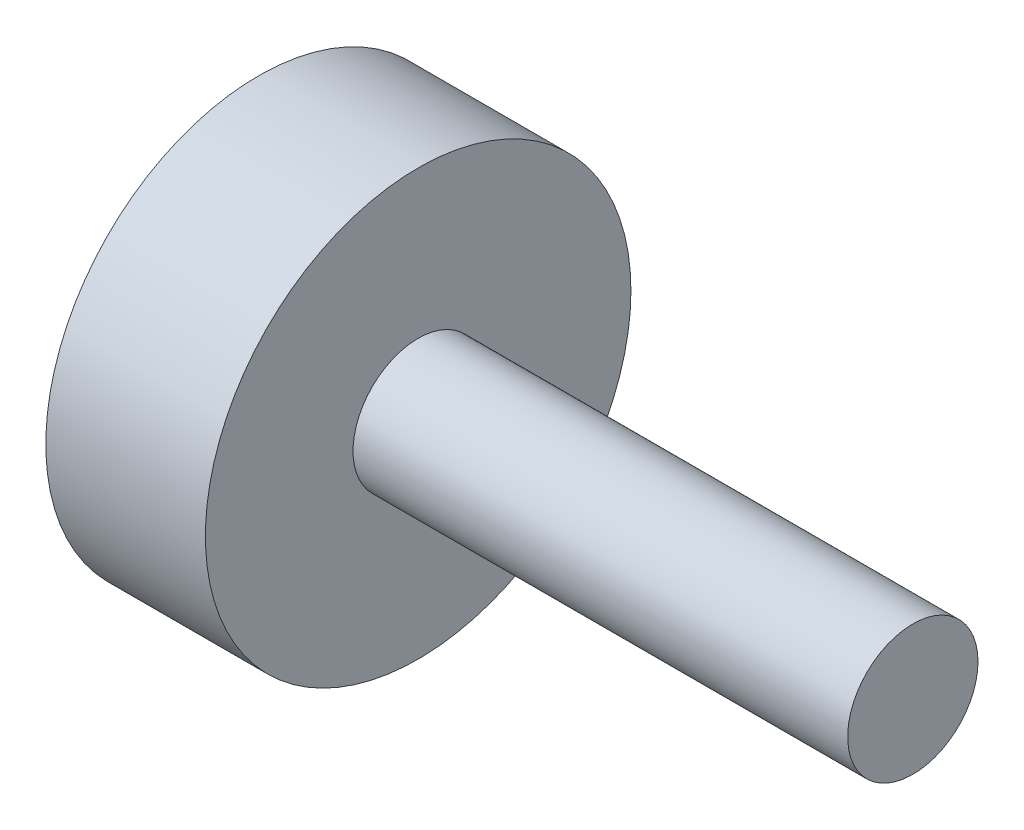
SolidWorks part; units mm, degrees
ref_plane "Front" through (0, 0, 0) normal (0, 0, 1) x (1, 0, 0)
ref_plane "Top" through (0, 0, 0) normal (0, 1, 0) x (1, 0, 0)
ref_plane "Right" through (0, 0, 0) normal (1, 0, 0) x (0, 0, -1)
sketch "Esboço1" plane through (0, 0, 0) normal (1, 0, 0) x (0, 0, -1)
  circle A0 centre (0, 0) radius 1.025
  circle A1 centre (0, 0) radius 4
  dimension "D1" = 2.05
  dimension "D2" = 8
extrude "Ressalto-extrusão1" add sketch "Esboço1" along normal blind 3
sketch "Esboço2" plane through (3, 0, 0) normal (1, 0, 0) x (0, 0, -1)
  circle A0 centre (0, 0) radius 1.225
  dimension "D1" = 2.45
extrude "Ressalto-extrusão2" add sketch "Esboço2" along normal blind 9.3
